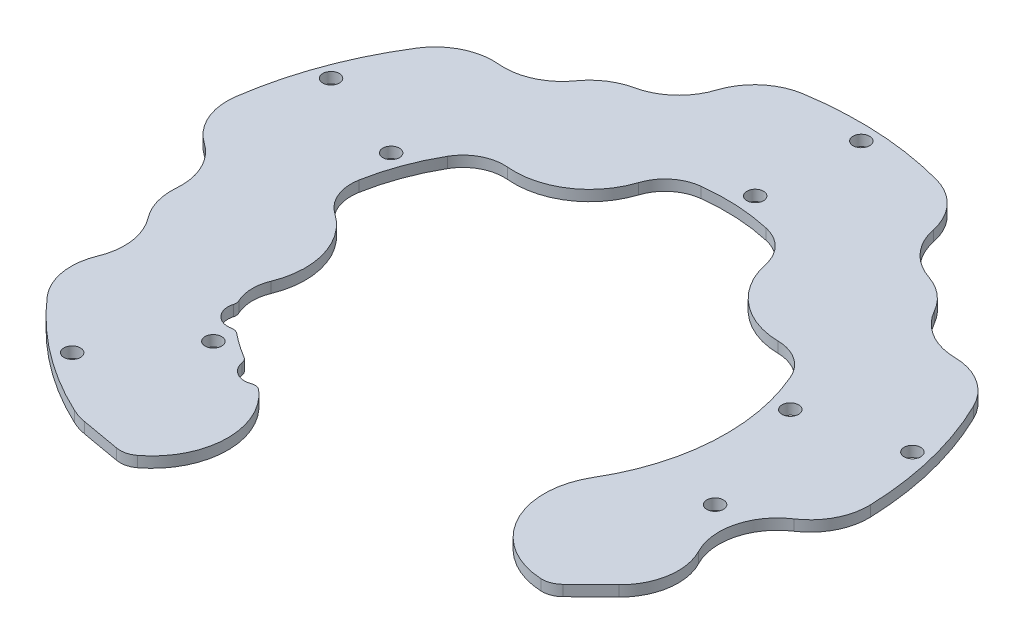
SolidWorks part; units mm, degrees
ref_plane "Front Plane" through (0, 0, 0) normal (0, 0, 1) x (1, 0, 0)
ref_plane "Top Plane" through (0, 0, 0) normal (0, 1, 0) x (1, 0, 0)
ref_plane "Right Plane" through (0, 0, 0) normal (1, 0, 0) x (0, 0, -1)
sketch "Sketch1" plane through (0, 0, 0) normal (0, 1, 0) x (1, 0, 0)
  arc A0 (56.1044, -33.3693) -> (59.7737, 26.236) centre (0, 0) ccw
  arc A1 (-51.0146, -26.2866) -> (-47.6314, -44.637) centre (-35.0286, -32.8264) ccw
  arc A2 (-68.2527, 61.1307) -> (-52.5449, 68.3132) centre (-66.619, 78.3253) ccw
  arc A3 (-42.1405, 75.1787) -> (-29.3588, 86.7955) centre (-45.81, 92.0564) ccw
  arc A4 (38.5076, 83.1418) -> (49.9682, 70.2199) centre (55.4286, 86.6061) ccw
  arc A5 (59.5755, 62.277) -> (74.4214, 53.4496) centre (74.6431, 70.7202) ccw
  arc A6 (92.029, -11.7615) -> (86.2498, -34.1853) centre (101.5504, -26.1721) ccw
  arc A7 (-57.1167, -5.5825) -> (-64.2265, 11.6695) centre (-47.2327, 8.5819) cw
  arc A8 (-56.6114, 32.5017) -> (-40.0517, 41.1016) centre (-41.6325, 23.9021) cw
  arc A9 (-22.0358, 52.9896) -> (-7.6159, 64.8322) centre (-5.6008, 47.6782) cw
  arc A10 (14.5324, 63.6398) -> (27.5975, 50.3175) centre (10.6873, 46.8013) cw
  arc A11 (44.233, 36.564) -> (59.7737, 26.236) centre (43.9581, 19.2941) cw
  arc A12 (-47.6314, -44.637) -> (-27.5877, -59.162) centre (0, 0) ccw
  circle A13 centre (-34.8871, -74.8157) radius 17.272
  arc A14 (-42.1866, -90.4695) -> (-27.5877, -59.162) centre (-34.8871, -74.8157) ccw
  arc A15 (-56.6114, 32.5017) -> (-64.2265, 11.6695) centre (0, 0) ccw
  circle A16 centre (-62.4471, -53.9894) radius 17.272
  arc A17 (-78.413, -47.4005) -> (-75.513, -65.2857) centre (-62.4471, -53.9894) ccw
  arc A18 (14.5324, 63.6398) -> (-7.6159, 64.8322) centre (0, 0) ccw
  circle A19 centre (-67.0006, -19.7468) radius 17.272
  arc A20 (-84.2138, -18.3222) -> (-80.6897, -30.2792) centre (-67.0006, -19.7468) ccw
  arc A21 (27.5975, 50.3175) -> (44.233, 36.564) centre (44.5078, 53.8338) ccw
  circle A22 centre (-81.7462, 11.4919) radius 17.272
  arc A23 (-98.85, 13.8963) -> (-91.5866, -2.7028) centre (-81.7462, 11.4919) ccw
  arc A24 (-40.0517, 41.1016) -> (-22.0358, 52.9896) centre (-38.4709, 58.3011) ccw
  circle A25 centre (-69.8864, 43.9362) radius 17.272
  arc A26 (-68.2527, 61.1307) -> (-84.5088, 53.129) centre (-69.8864, 43.9362) ccw
  arc A27 (-51.0146, -26.2866) -> (-57.1167, -5.5825) centre (-67.0006, -19.7468) ccw
  circle A28 centre (-38.4709, 58.3011) radius 17.272
  arc A29 (-42.1405, 75.1787) -> (-52.5449, 68.3132) centre (-38.4709, 58.3011) ccw
  arc A30 (-84.5088, 53.129) -> (-98.85, 13.8963) centre (0, 0) ccw
  circle A31 centre (-12.9075, 81.5347) radius 17.272
  arc A32 (-15.6081, 98.5942) -> (-29.3588, 86.7955) centre (-12.9075, 81.5347) ccw
  arc A33 (26.1032, 96.3486) -> (-15.6081, 98.5942) centre (0, 0) ccw
  circle A34 centre (21.5866, 79.6776) radius 17.272
  arc A35 (38.5076, 83.1418) -> (26.1032, 96.3486) centre (21.5866, 79.6776) ccw
  arc A36 (99.7706, 3.2032) -> (89.7244, 43.7488) centre (0, 0) ccw
  circle A37 centre (44.5078, 53.8338) radius 17.272
  arc A38 (59.5755, 62.277) -> (49.9682, 70.2199) centre (44.5078, 53.8338) ccw
  circle A40 centre (74.1996, 36.1791) radius 17.272
  arc A41 (89.7244, 43.7488) -> (74.4214, 53.4496) centre (74.1996, 36.1791) ccw
  circle A44 centre (82.5075, 2.649) radius 17.272
  arc A45 (92.029, -11.7615) -> (99.7706, 3.2032) centre (82.5075, 2.649) ccw
  arc A46 (-75.513, -65.2857) -> (-42.1866, -90.4695) centre (0, 0) ccw
  circle A47 centre (70.9492, -42.1986) radius 17.272
  arc A48 (56.1044, -33.3693) -> (86.2498, -34.1853) centre (70.9492, -42.1986) ccw
  arc A49 (-80.6897, -30.2792) -> (-78.413, -47.4005) centre (-94.3788, -40.8116) cw
  arc A50 (-91.5866, -2.7028) -> (-84.2138, -18.3222) centre (-101.4269, -16.8975) cw
  dimension "D1" = 0
  dimension "D2" = 0
  dimension "D3" = 0
  dimension "D4" = 0
  dimension "D5" = 0
  dimension "D6" = 0
  dimension "D7" = 0
  dimension "D8" = 0
  dimension "D9" = 0
  dimension "D10" = 0
  dimension "D11" = 0
  dimension "D12" = 0
extrude "Boss-Extrude1" add sketch "Sketch1" along normal blind 3.175
sketch "Sketch4" plane through (0, 3.175, 0) normal (0, 1, 0) x (1, 0, 0)
  line L0 (-37.8864, -91.8253) -> (-26.369, -93.8561)
  line L1 (83.0029, -54.5691) -> (74.6267, -62.7308)
  line L2 (0, 0) -> (-34.8871, -74.8157) construction
  line L3 (0, 0) -> (70.9492, -42.1986) construction
  line L4 (-34.8871, -74.8157) -> (-7.033, -87.8043) construction
  line L5 (70.9492, -42.1986) -> (52.2375, -73.6588) construction
  arc A0 (-45.9299, -39.7668) -> (-40.0937, -46.1513) centre (-41.045, -41.1612) ccw
  arc A1 (-29.6552, -53.4604) -> (-22.8653, -57.4073) centre (-24.6407, -52.6476) ccw
  circle A2 centre (-41.045, -41.1612) radius 2.4574 construction
  circle A3 centre (-24.6407, -52.6476) radius 2.4574 construction
  arc A4 (-22.8653, -57.4073) -> (-20.3225, -57.8604) centre (-21.9776, -59.7871) cw
  arc A5 (-29.6552, -53.4604) -> (-30.8604, -51.6859) centre (-32.1625, -53.8668) ccw
  arc A6 (-40.0937, -46.1513) -> (-38.014, -46.6769) centre (-39.618, -48.6464) cw
  arc A7 (-45.9299, -39.7668) -> (-46.0717, -37.9932) centre (-48.3723, -39.0696) ccw
  arc A8 (-42.1866, -90.4695) -> (-27.5877, -59.162) centre (-34.8871, -74.8157) ccw construction
  arc A9 (-42.1866, -90.4695) -> (-27.5877, -59.162) centre (-34.8871, -74.8157) ccw construction
  arc A10 (-26.369, -93.8561) -> (-21.4486, -92.6768) centre (-25.2664, -87.6026) ccw
  arc A12 (69.896, -64.5258) -> (74.6267, -62.7308) centre (70.1952, -58.1828) ccw
  arc A36 (56.1044, -33.3693) -> (86.2498, -34.1853) centre (70.9492, -42.1986) ccw construction
  arc A37 (51.7383, -30.7725) -> (55.122, 24.1942) centre (0, 0) ccw
  arc A38 (51.7383, -30.7725) -> (55.122, 24.1942) centre (0, 0) ccw
  arc A39 (-43.9247, -41.1633) -> (-25.4408, -54.5579) centre (0, 0) ccw
  arc A40 (-38.014, -46.6769) -> (-30.8604, -51.6859) centre (0, 0) ccw
  arc A41 (-52.2059, 29.9724) -> (-59.2283, 10.7614) centre (0, 0) ccw
  arc A42 (-52.2059, 29.9724) -> (-59.2283, 10.7614) centre (0, 0) ccw
  arc A43 (13.4015, 58.6873) -> (-7.0232, 59.7869) centre (0, 0) ccw
  arc A44 (13.4015, 58.6873) -> (-7.0232, 59.7869) centre (0, 0) ccw
  arc A72 (55.122, 24.1942) -> (44.1521, 31.4846) centre (43.9581, 19.2941) ccw
  arc A74 (51.7383, -30.7725) -> (90.75, -31.8285) centre (70.9492, -42.1986) ccw
  arc A75 (94.8294, -15.9999) -> (90.75, -31.8285) centre (101.5504, -26.1721) ccw
  arc A76 (94.8294, -15.9999) -> (104.848, 3.3662) centre (82.5075, 2.649) ccw
  arc A77 (104.848, 3.3662) -> (94.2905, 45.9752) centre (0, 0) ccw
  arc A78 (94.2905, 45.9752) -> (74.4866, 58.5292) centre (74.1996, 36.1791) ccw
  arc A79 (64.0071, 64.7603) -> (74.4866, 58.5292) centre (74.6431, 70.7202) ccw
  arc A80 (64.0071, 64.7603) -> (51.5742, 75.0394) centre (44.5078, 53.8338) ccw
  arc A81 (43.4844, 84.1607) -> (51.5742, 75.0394) centre (55.4286, 86.6061) ccw
  arc A82 (43.4844, 84.1607) -> (27.4316, 101.2519) centre (21.5866, 79.6776) ccw
  arc A83 (27.4316, 101.2519) -> (-16.4024, 103.6117) centre (0, 0) ccw
  arc A84 (-16.4024, 103.6117) -> (-34.1974, 88.3429) centre (-12.9075, 81.5347) ccw
  arc A85 (-43.2197, 80.1428) -> (-34.1974, 88.3429) centre (-45.81, 92.0564) ccw
  arc A86 (-43.2197, 80.1428) -> (-56.6844, 71.2579) centre (-38.4709, 58.3011) ccw
  arc A87 (-67.7722, 66.188) -> (-56.6844, 71.2579) centre (-66.619, 78.3253) ccw
  arc A88 (-67.7722, 66.188) -> (-88.8095, 55.8327) centre (-69.8864, 43.9362) ccw
  arc A89 (-88.8095, 55.8327) -> (-103.8805, 14.6035) centre (0, 0) ccw
  arc A90 (-103.8805, 14.6035) -> (-94.4808, -6.8777) centre (-81.7462, 11.4919) ccw
  arc A91 (-89.2765, -17.9032) -> (-94.4808, -6.8777) centre (-101.4269, -16.8975) ccw
  arc A92 (-89.2765, -17.9032) -> (-84.7159, -33.377) centre (-67.0006, -19.7468) ccw
  arc A93 (-83.1088, -45.4626) -> (-84.7159, -33.377) centre (-94.3788, -40.8116) ccw
  arc A94 (-83.1088, -45.4626) -> (-79.3559, -68.6081) centre (-62.4471, -53.9894) ccw
  arc A95 (-79.3559, -68.6081) -> (-44.3335, -95.0735) centre (0, 0) ccw
  arc A96 (-44.3335, -95.0735) -> (-25.4408, -54.5579) centre (-34.8871, -74.8157) ccw
  arc A98 (-46.3128, -28.2101) -> (-43.9247, -41.1633) centre (-35.0286, -32.8264) ccw
  arc A99 (-46.3128, -28.2101) -> (-54.2096, -1.4165) centre (-67.0006, -19.7468) ccw
  arc A100 (-59.2283, 10.7614) -> (-54.2096, -1.4165) centre (-47.2327, 8.5819) ccw
  arc A102 (-40.5167, 36.0429) -> (-52.2059, 29.9724) centre (-41.6325, 23.9021) ccw
  arc A103 (-40.5167, 36.0429) -> (-17.202, 51.4274) centre (-38.4709, 58.3011) ccw
  arc A104 (-7.0232, 59.7869) -> (-17.202, 51.4274) centre (-5.6008, 47.6782) ccw
  arc A106 (22.6239, 49.2833) -> (13.4015, 58.6873) centre (10.6873, 46.8013) ccw
  arc A107 (22.6239, 49.2833) -> (44.1521, 31.4846) centre (44.5078, 53.8338) ccw
  arc A108 (55.122, 24.1942) -> (44.1521, 31.4846) centre (43.9581, 19.2941) ccw
  arc A110 (51.7383, -30.7725) -> (69.896, -64.5258) centre (70.9492, -42.1986) ccw
  arc A132 (-21.4486, -92.6768) -> (-20.3225, -57.8604) centre (-34.8871, -74.8157) ccw
  arc A134 (-46.3128, -28.2101) -> (-46.0717, -37.9932) centre (-35.0286, -32.8264) ccw
  arc A135 (-46.3128, -28.2101) -> (-54.2096, -1.4165) centre (-67.0006, -19.7468) ccw
  arc A136 (-59.2283, 10.7614) -> (-54.2096, -1.4165) centre (-47.2327, 8.5819) ccw
  arc A138 (-40.5167, 36.0429) -> (-52.2059, 29.9724) centre (-41.6325, 23.9021) ccw
  arc A139 (-40.5167, 36.0429) -> (-17.202, 51.4274) centre (-38.4709, 58.3011) ccw
  arc A140 (-7.0232, 59.7869) -> (-17.202, 51.4274) centre (-5.6008, 47.6782) ccw
  arc A142 (22.6239, 49.2833) -> (13.4015, 58.6873) centre (10.6873, 46.8013) ccw
  arc A143 (22.6239, 49.2833) -> (44.1521, 31.4846) centre (44.5078, 53.8338) ccw
  arc A181 (59.7737, 26.236) -> (44.233, 36.564) centre (43.9581, 19.2941) ccw
  arc A182 (56.1044, -33.3693) -> (59.7737, 26.236) centre (0, 0) ccw
  arc A183 (56.1044, -33.3693) -> (86.2498, -34.1853) centre (70.9492, -42.1986) ccw
  arc A184 (92.029, -11.7615) -> (86.2498, -34.1853) centre (101.5504, -26.1721) ccw
  arc A185 (92.029, -11.7615) -> (99.7706, 3.2032) centre (82.5075, 2.649) ccw
  arc A186 (99.7706, 3.2032) -> (89.7244, 43.7488) centre (0, 0) ccw
  arc A187 (89.7244, 43.7488) -> (74.4214, 53.4496) centre (74.1996, 36.1791) ccw
  arc A188 (59.5755, 62.277) -> (74.4214, 53.4496) centre (74.6431, 70.7202) ccw
  arc A189 (59.5755, 62.277) -> (49.9682, 70.2199) centre (44.5078, 53.8338) ccw
  arc A190 (38.5076, 83.1418) -> (49.9682, 70.2199) centre (55.4286, 86.6061) ccw
  arc A191 (38.5076, 83.1418) -> (26.1032, 96.3486) centre (21.5866, 79.6776) ccw
  arc A192 (26.1032, 96.3486) -> (-15.6081, 98.5942) centre (0, 0) ccw
  arc A193 (-15.6081, 98.5942) -> (-29.3588, 86.7955) centre (-12.9075, 81.5347) ccw
  arc A194 (-42.1405, 75.1787) -> (-29.3588, 86.7955) centre (-45.81, 92.0564) ccw
  arc A195 (-42.1405, 75.1787) -> (-52.5449, 68.3132) centre (-38.4709, 58.3011) ccw
  arc A196 (-68.2527, 61.1307) -> (-52.5449, 68.3132) centre (-66.619, 78.3253) ccw
  arc A197 (-68.2527, 61.1307) -> (-84.5088, 53.129) centre (-69.8864, 43.9362) ccw
  arc A198 (-84.5088, 53.129) -> (-98.85, 13.8963) centre (0, 0) ccw
  arc A199 (-98.85, 13.8963) -> (-91.5866, -2.7028) centre (-81.7462, 11.4919) ccw
  arc A200 (-84.2138, -18.3222) -> (-91.5866, -2.7028) centre (-101.4269, -16.8975) ccw
  arc A201 (-84.2138, -18.3222) -> (-80.6897, -30.2792) centre (-67.0006, -19.7468) ccw
  arc A202 (-78.413, -47.4005) -> (-80.6897, -30.2792) centre (-94.3788, -40.8116) ccw
  arc A203 (-78.413, -47.4005) -> (-75.513, -65.2857) centre (-62.4471, -53.9894) ccw
  arc A204 (-75.513, -65.2857) -> (-42.1866, -90.4695) centre (0, 0) ccw
  arc A205 (-42.1866, -90.4695) -> (-27.5877, -59.162) centre (-34.8871, -74.8157) ccw
  arc A206 (-47.6314, -44.637) -> (-27.5877, -59.162) centre (0, 0) ccw
  arc A207 (-51.0146, -26.2866) -> (-47.6314, -44.637) centre (-35.0286, -32.8264) ccw
  arc A208 (-51.0146, -26.2866) -> (-57.1167, -5.5825) centre (-67.0006, -19.7468) ccw
  arc A209 (-64.2265, 11.6695) -> (-57.1167, -5.5825) centre (-47.2327, 8.5819) ccw
  arc A210 (-56.6114, 32.5017) -> (-64.2265, 11.6695) centre (0, 0) ccw
  arc A211 (-40.0517, 41.1016) -> (-56.6114, 32.5017) centre (-41.6325, 23.9021) ccw
  arc A212 (-40.0517, 41.1016) -> (-22.0358, 52.9896) centre (-38.4709, 58.3011) ccw
  arc A213 (-7.6159, 64.8322) -> (-22.0358, 52.9896) centre (-5.6008, 47.6782) ccw
  arc A214 (14.5324, 63.6398) -> (-7.6159, 64.8322) centre (0, 0) ccw
  arc A215 (27.5975, 50.3175) -> (14.5324, 63.6398) centre (10.6873, 46.8013) ccw
  arc A216 (27.5975, 50.3175) -> (44.233, 36.564) centre (44.5078, 53.8338) ccw
  arc A217 (59.7737, 26.236) -> (44.233, 36.564) centre (43.9581, 19.2941) ccw
  arc A218 (56.1044, -33.3693) -> (59.7737, 26.236) centre (0, 0) ccw
  arc A219 (56.1044, -33.3693) -> (83.0029, -54.5691) centre (70.9492, -42.1986) ccw
  arc A241 (-37.8864, -91.8253) -> (-27.5877, -59.162) centre (-34.8871, -74.8157) ccw
  arc A242 (-47.6314, -44.637) -> (-27.5877, -59.162) centre (0, 0) ccw
  arc A243 (-51.0146, -26.2866) -> (-47.6314, -44.637) centre (-35.0286, -32.8264) ccw
  arc A244 (-51.0146, -26.2866) -> (-57.1167, -5.5825) centre (-67.0006, -19.7468) ccw
  arc A245 (-64.2265, 11.6695) -> (-57.1167, -5.5825) centre (-47.2327, 8.5819) ccw
  arc A246 (-56.6114, 32.5017) -> (-64.2265, 11.6695) centre (0, 0) ccw
  arc A247 (-40.0517, 41.1016) -> (-56.6114, 32.5017) centre (-41.6325, 23.9021) ccw
  arc A248 (-40.0517, 41.1016) -> (-22.0358, 52.9896) centre (-38.4709, 58.3011) ccw
  arc A249 (-7.6159, 64.8322) -> (-22.0358, 52.9896) centre (-5.6008, 47.6782) ccw
  arc A250 (14.5324, 63.6398) -> (-7.6159, 64.8322) centre (0, 0) ccw
  arc A251 (27.5975, 50.3175) -> (14.5324, 63.6398) centre (10.6873, 46.8013) ccw
  arc A252 (27.5975, 50.3175) -> (44.233, 36.564) centre (44.5078, 53.8338) ccw
  dimension "D3" = 5.08
  dimension "D4" = 2.54
  dimension "D5" = 6.35
  dimension "D7" = 6.35
  dimension "D6" = 15
  dimension "D8" = 15
  dimension "D1" = 5.08
  dimension "D2" = 0
extrude "Boss-Extrude2" add sketch "Sketch4" against normal up to surface (3.175 mm away)
hole_wizard "#10 (0.1935) Diameter Hole1" positions "Sketch3" profile "Sketch2" hole size "#10" standard "ANSI Inch"
sketch "Sketch3" plane through (0, 3.175, 0) normal (0, 1, 0) x (1, 0, 0)
  line L0 (0, 0) -> (-57.4254, -75.9926) construction
  line L2 (0, 0) -> (-89.4605, 32.7015) construction
  line L3 (0, 0) -> (5.1205, 95.1123) construction
  line L4 (0, 0) -> (92.4543, 22.9078) construction
  line L5 (82.5075, 2.649) -> (70.9492, -42.1986) construction
  circle A0 centre (0, 0) radius 95.25 construction
  circle A1 centre (0, 0) radius 65.405 construction
  point P0 (-57.4254, -75.9926)
  point P2 (-89.4605, 32.7015)
  point P4 (5.1205, 95.1123)
  point P6 (92.4543, 22.9078)
  point P8 (76.7283, -19.7748)
  point P50 (-39.4321, -52.1816)
  point P52 (-61.4295, 22.455)
  point P54 (3.5161, 65.3104)
  point P56 (63.4853, 15.73)
  dimension "D1" = 190.5
  dimension "D2" = 130.81
sketch "Sketch2" plane through (-57.4254, 3.175, 75.9926) normal (1, 0, 0) x (0, 0, 1)
  line L0 (0, 0) -> (0, 3.175)
  line L1 (0, 3.175) -> (2.4574, 3.175)
  line L2 (2.4574, 3.175) -> (2.4574, 0)
  line L5 (2.4574, 0) -> (0, 0)
  line L11 (0, -6.35) -> (0, 107.95) construction
  dimension "Thru Hole Dia." = 4.9149
  dimension "Thru Hole Depth" = 3.175
